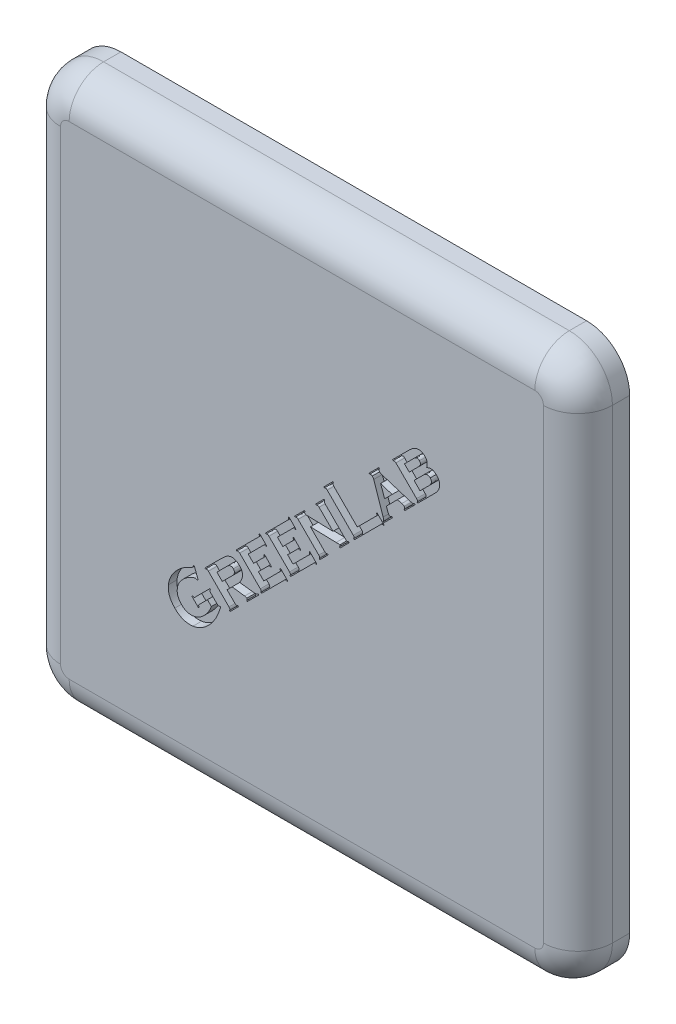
SolidWorks part; units mm, degrees
ref_plane "Front Plane" through (0, 0, 0) normal (0, 0, 1) x (1, 0, 0)
ref_plane "Top Plane" through (0, 0, 0) normal (0, 1, 0) x (1, 0, 0)
ref_plane "Right Plane" through (0, 0, 0) normal (1, 0, 0) x (0, 0, -1)
ref_plane "Plane1" through (0, 0, 3) normal (0, 0, 1) x (1, 0, 0)
sketch "Sketch1" plane through (0, 0, 3) normal (0, 0, 1) x (1, 0, 0)
  line L0 (-9.5, -9.5) -> (22.5, -9.5)
  line L1 (22.5, -9.5) -> (22.5, 22.5)
  line L2 (22.5, 22.5) -> (-9.5, 22.5)
  line L3 (-9.5, 22.5) -> (-9.5, -9.5)
  dimension "D1" = 32
  dimension "D2" = 32
extrude "Boss-Extrude1" add sketch "Sketch1" against normal blind 3
fillet "Fillet1" radius 2.5 4 edges at (22.5, 22.5, 1.5) (22.5, -9.5, 1.5) (-9.5, 22.5, 1.5) (-9.5, -9.5, 1.5)
fillet "Fillet2" radius 2 8 edges at (-8.7678, 21.7678, 3) (6.5, 22.5, 3) (-9.5, 6.5, 3) (21.7678, 21.7678, 3) (-8.7678, -8.7678, 3) (22.5, 6.5, 3) (6.5, -9.5, 3) (21.7678, -8.7678, 3)
sketch "Sketch3" plane through (0, 0, 3) normal (0, 0, 1) x (1, 0, 0)
  line L0 (-7.5, 5.25) -> (20.5, 5.25) construction
  line L1 (-7.5, 20) -> (-7.5, -7) construction
  line L2 (20.5, -7) -> (20.5, 20) construction
  line L3 (20, -9.5) -> (-7, -9.5) construction
  line L4 (-7.3536, -7.3536) -> (20.3536, 20.3536) construction
  line L5 (6.5078, 6.4922) -> (35361.379, -35348.379) construction
  line L6 (16.247, 14.4792) -> (-1.4792, -3.247) construction
  arc A0 (-7.5, -7) -> (-7, -7.5) centre (-7, -7) ccw construction
  arc A1 (20.5, 20) -> (20, 20.5) centre (20, 20) ccw construction
  text T0 "GreenLab" font "Copperplate Gothic Bold" height 2.5
  point P16 (6.5, 6.5)
  point P20 (7.3839, 5.6161)
  dimension "D1" = 14.75
  dimension "D2" = 1.25
extrude "Cut-Extrude1" cut sketch "Sketch3" against normal blind 0.5
